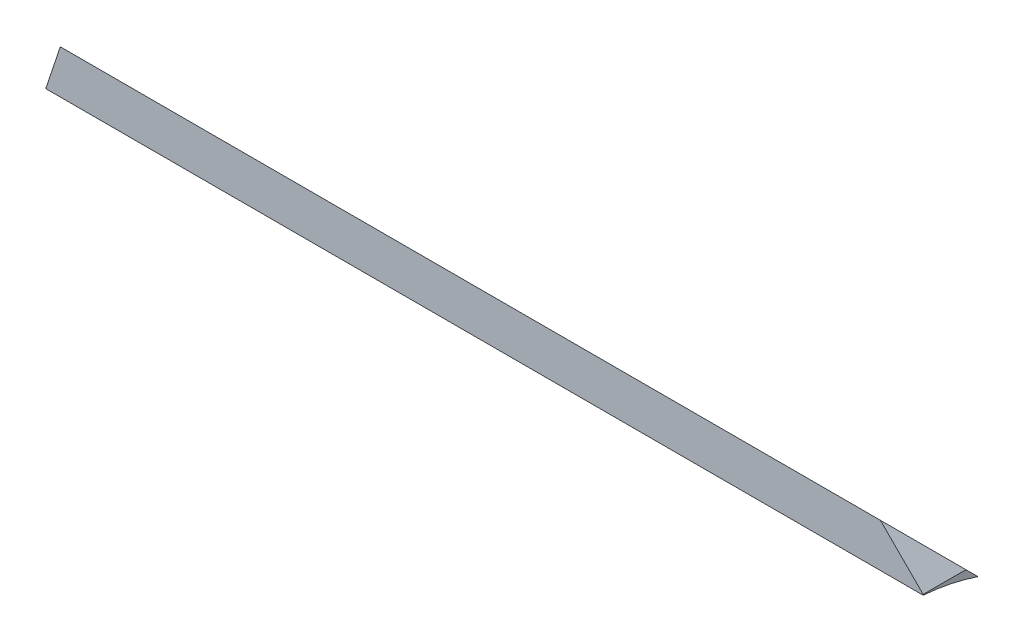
SolidWorks part; units mm, degrees
ref_plane "Front Plane" through (0, 0, 0) normal (0, 0, 1) x (1, 0, 0)
ref_plane "Top Plane" through (0, 0, 0) normal (0, 1, 0) x (1, 0, 0)
ref_plane "Right Plane" through (0, 0, 0) normal (1, 0, 0) x (0, 0, -1)
sketch "Sketch1" plane through (0, 0, 0) normal (0, 1, 0) x (1, 0, 0)
  line L1 (0, 0) -> (152.4, 0)
  line L2 (0, 0) -> (0, 12.7)
  line L3 (0, 12.7) -> (152.4, 12.7)
  line L4 (152.4, 0) -> (152.4, 12.7)
  dimension "D1" = 152.4
  dimension "D2" = 12.7
extrude "Extrude1" add sketch "Sketch1" along normal blind 12.7
sketch "Sketch2" plane through (152.4, 0, 0) normal (1, 0, 0) x (0, 0, -1)
  line L0 (0, 12.7) -> (12.7, 0)
  line L1 (0, 12.7) -> (12.7, 12.7)
  line L2 (12.7, 12.7) -> (12.7, 0)
extrude "Cut-Extrude1" cut sketch "Sketch2" against normal through all
sketch "Sketch3" plane through (152.4, 0, 0) normal (1, 0, 0) x (0, 0, -1)
  line L0 (0, 2.0869) -> (0, 19.3204)
  line L1 (0, 19.3204) -> (3.175, 19.3204)
  line L2 (3.175, 19.3204) -> (3.175, 1.9597)
  arc A0 (0, 2.0869) -> (3.175, 1.9597) centre (0, -37.6006) ccw
  dimension "D1" = 39.6875
  dimension "D2" = 3.175
extrude "Cut-Extrude2" cut sketch "Sketch3" against normal through all
sketch "Sketch5" plane through (0, 0, 0) normal (0, 0, 1) x (1, 0, 0)
  line L0 (0, 2.0869) -> (0, 0)
  line L1 (152.4, 2.0869) -> (76.2, 78.2869)
  line L2 (76.2, 78.2869) -> (25.4, 78.2869)
  line L3 (25.4, 78.2869) -> (0, 2.0869)
  line L4 (0, 0) -> (152.4, 0)
  line L5 (152.4, 0) -> (152.4, 2.0869)
  dimension "D1" = 152.4
  dimension "D2" = 76.2
  dimension "D4" = 25.4
extrude "Cut-Extrude6" cut sketch "Sketch5" against normal through all flip side to cut
